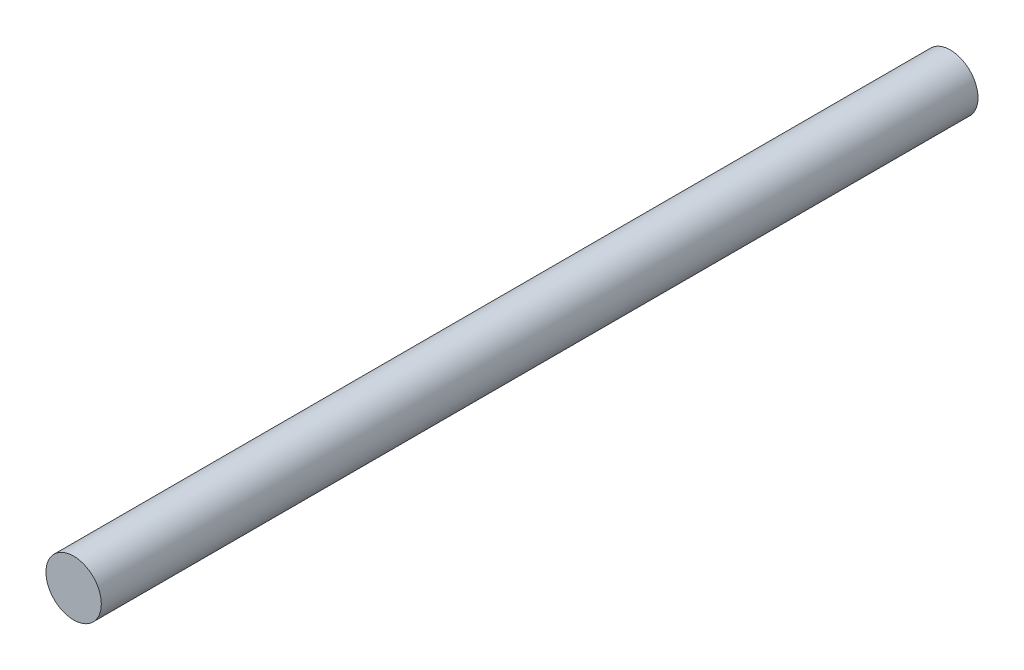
SolidWorks part; units mm, degrees
ref_plane "Front Plane" through (0, 0, 0) normal (0, 0, 1) x (1, 0, 0)
ref_plane "Top Plane" through (0, 0, 0) normal (0, 1, 0) x (1, 0, 0)
ref_plane "Right Plane" through (0, 0, 0) normal (1, 0, 0) x (0, 0, -1)
sketch "Sketch1" plane through (0, 0, 0) normal (0, 0, 1) x (1, 0, 0)
  circle A0 centre (0, 0) radius 3
  dimension "D1" = 6
extrude "Extrude1" add sketch "Sketch1" along normal blind 95
